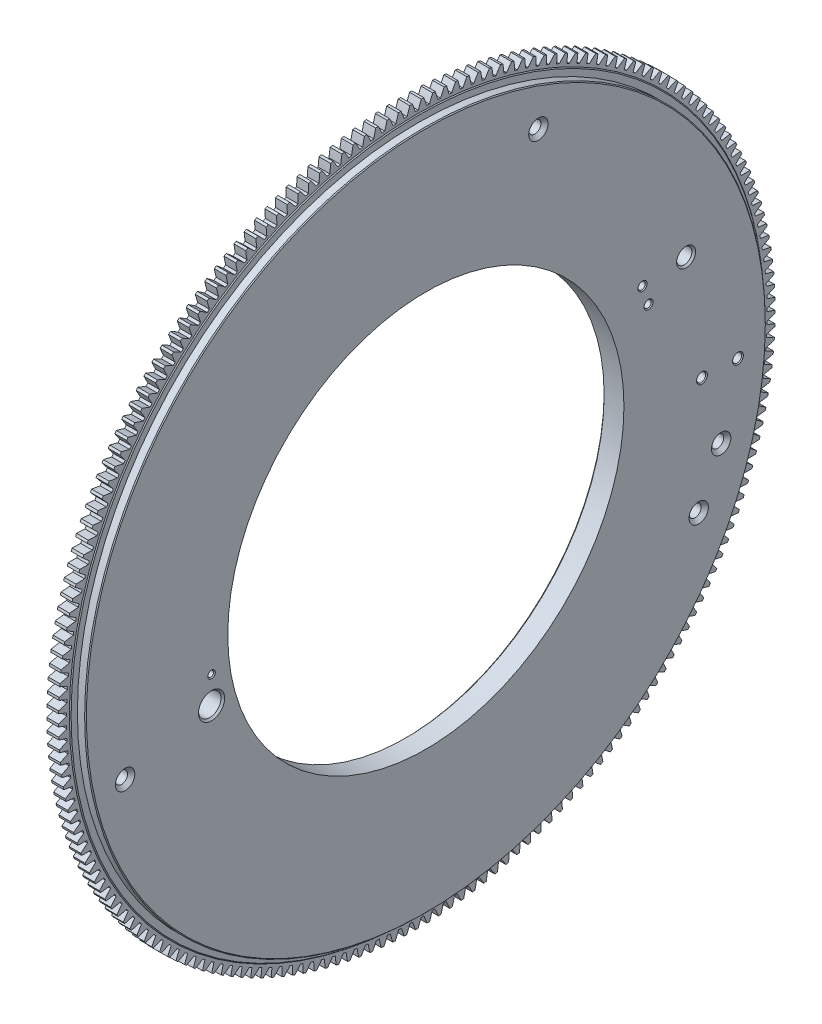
SolidWorks part; units mm, degrees
ref_plane "Plane1" through (0, 0, 0) normal (0, 0, 1) x (1, 0, 0)
ref_plane "Plane2" through (0, 0, 0) normal (0, 1, 0) x (1, 0, 0)
ref_plane "Plane3" through (0, 0, 0) normal (1, 0, 0) x (0, 0, -1)
sketch "HoldingSke" plane through (0, 0, 0) normal (0, 1, 0) x (1, 0, 0)
  line L0 (0, 0) -> (0.4698, -0.171)
  line L1 (-15, 0) -> (100, 0) construction
  line L2 (0, 0) -> (-2.1039, 2.3779)
  line L3 (0, 0) -> (-11.863, 4.5341)
  line L4 (0, 0) -> (-8.2586, -2.5249)
  line L5 (0, 0) -> (-46.8476, -17.4728)
  line L6 (0, 0) -> (-10.7765, -7.2709)
  line L7 (-2.1039, 2.3779) -> (8.6586, 51.206)
  line L8 (-76.2, 54.61) -> (-73.4, 54.61)
  line L9 (-71.009, 38.7566) -> (-53.1078, 45.2721)
  line L10 (-76.2, 71.12) -> (104.1128, 71.12)
  line L11 (0, 0) -> (-13, 0)
  line L12 (-76.2, 101.6) -> (-76.133, 101.6)
  line L13 (24.9733, 27.94) -> (52.9518, 28.4284)
  line L14 (24.9733, 27.94) -> (24.9743, 27.94)
  line L15 (24.9733, 27.94) -> (100.4006, 29.5858)
  line L16 (-63.627, -2) -> (-12.827, -2)
  circle A0 centre (0, 0) radius 9
  circle A1 centre (0, 0) radius 37.5
  circle A2 centre (0, 0) radius 37.5
  circle A3 centre (0, 0) radius 9
sketch "BasProSke" plane through (0, 0, 0) normal (0, 1, 0) x (1, 0, 0)
  line L0 (-10, 0) -> (60, 0) construction
  line L1 (0, 0) -> (0, 199)
  line L2 (0, 0) -> (13, 0)
  line L3 (13, 0) -> (13, 199)
  line L4 (13, 199) -> (0, 199)
revolve "Base-Revolve" add sketch "BasProSke" angle 360 about L0
sketch "TooCutSke" plane through (0, 0, 0) normal (1, 0, 0) x (0, 0, -1)
  line L1 (0, 0) -> (0, 107) construction
  line L2 (0, 0) -> (-1.688, 196.9928) construction
  line L3 (0, 0) -> (-6.2827, 393.9392) construction
  line L4 (-1.688, 196.9928) -> (-3.1414, 196.9696) construction
  arc A0 (0.7905, 194.4974) -> (-0.7905, 194.4974) centre (0, 0) ccw
  arc A1 (2.4841, 199.0099) -> (-2.4841, 199.0099) centre (0, 0) ccw
  circle A2 centre (0, 0) radius 197 construction
  circle A3 centre (0, 0) radius 185.1194 construction
  arc A4 (-0.7905, 194.4974) -> (-2.4841, 199.0099) centre (-75.378, 169.078) ccw
  arc A5 (2.4841, 199.0099) -> (0.7905, 194.4974) centre (75.378, 169.078) ccw
extrude "ToothCut" cut sketch "TooCutSke" along normal through all
fillet "Breaks" [suppressed] radius 0.04
fillet "RootFillets" [suppressed] radius 0.501
pattern_circular "TeethCuts" count 197 over 360 about axis through (0, 0, 0) along (1, 0, 0) of "ToothCut"
sketch "HubNeaOneSke" plane through (0, 0, 0) normal (-1, 0, 0) x (0, 0, 1)
  circle A0 centre (0, 0) radius 37.5
extrude "HubNearOne" [suppressed] add sketch "HubNeaOneSke" along normal blind 37.0002
sketch "HubNeaBotSke" plane through (0, 0, 0) normal (-1, 0, 0) x (0, 0, 1)
  circle A0 centre (0, 0) radius 37.5
extrude "HubNearBoth" [suppressed] add sketch "HubNeaBotSke" along normal blind 18.5001
ref_plane "FarPln" through (13, 0, 0) normal (1, 0, 0) x (0, 0, -1)
sketch "HubFarSke" plane through (13, 0, 0) normal (1, 0, 0) x (0, 0, -1)
  circle A0 centre (0, 0) radius 37.5
extrude "HubFar" [suppressed] add sketch "HubFarSke" along normal blind 18.5001
sketch "BorSke" plane through (0, 0, 0) normal (1, 0, 0) x (0, 0, -1)
  circle A0 centre (0, 0) radius 9
extrude "Bore" cut sketch "BorSke" along normal mid plane 100.0004
sketch "KeySke" plane through (0, 0, 0) normal (1, 0, 0) x (0, 0, -1)
  line L0 (-3, 0) -> (-3, 11.8)
  line L1 (-3, 11.8) -> (3, 11.8)
  line L2 (3, 11.8) -> (3, 0)
  line L3 (0, 0) -> (0, 34) construction
  line L4 (-3, 0) -> (3, 0)
extrude "Keyway" [suppressed] cut sketch "KeySke" along normal mid plane 100.0004
pattern_circular "Keyway2" [suppressed] count 2 every 90 about axis through (-10, 0, 0) along (1, 0, 0)
sketch "Esquisse1" plane through (13, 0, 0) normal (1, 0, 0) x (0, 0, -1)
  circle A0 centre (0, 0) radius 110
  dimension "D1" = 220
extrude "Extrusion1" cut sketch "Esquisse1" against normal through all
sketch "Esquisse2" plane through (13, 0, 0) normal (1, 0, 0) x (0, 0, -1)
  circle A1 centre (0, 0) radius 199
  arc A2 (3.873, 198.9623) -> (2.4737, 198.9846) centre (0, 0) ccw construction
extrude "Extrusion2" cut sketch "Esquisse2" against normal blind 1
chamfer "Chanfrein1" distance 1 angle 45 1 edges at (0, 0, -110)
sketch "Esquisse3" plane through (0, 0, 0) normal (-1, 0, 0) x (0, 0, 1)
  circle A0 centre (0, 0) radius 132
  circle A1 centre (0, 0) radius 178.5
  dimension "D1" = 264
  dimension "D2" = 357
extrude "Extrusion3" cut sketch "Esquisse3" against normal blind 1
sketch "Esquisse4" plane through (0, 0, 0) normal (-1, 0, 0) x (0, 0, 1)
  circle A0 centre (0, 0) radius 193
  circle A2 centre (0, 0) radius 199
  arc A3 (-2.4737, 198.9846) -> (-3.873, 198.9623) centre (0, 0) ccw construction
  dimension "D1" = 386
extrude "Extrusion4" cut sketch "Esquisse4" against normal blind 0.5
chamfer "Chanfrein2" distance 0.5 angle 45 3 edges at (0, 0, 132) (0, 0, 178.5) (0, 0, 193)
sketch "Esquisse5" plane through (12, 0, 0) normal (1, 0, 0) x (0, 0, -1)
  circle A1 centre (0, 0) radius 199
  circle A2 centre (0, 0) radius 189
  arc A3 (-120.4824, 158.3824) -> (-121.5933, 157.5312) centre (0, 0) ccw construction
  dimension "D1" = 378
extrude "Extrusion5" cut sketch "Esquisse5" against normal blind 4.5
sketch "Esquisse6" plane through (7.5, 0, 0) normal (1, 0, 0) x (0, 0, -1)
  circle A0 centre (0, 0) radius 193
  circle A1 centre (0, 0) radius 199
  arc A2 (-120.4824, 158.3824) -> (-121.5933, 157.5312) centre (0, 0) ccw construction
  dimension "D1" = 386
extrude "Extrusion6" cut sketch "Esquisse6" against normal blind 0.5
chamfer "Chanfrein3" distance 0.5 angle 45 1 edges at (7.5, 0, -193)
chamfer "Chanfrein4" distance 0.5 angle 45 1 edges at (12, 0, -189)
hole_wizard "Diamètre du perçage Ø12.5 (12.5)1" positions "Esquisse8" profile "Esquisse7" hole size "Ø12.5" standard "ISO"
sketch "Esquisse8" plane through (12, 0, 0) normal (1, 0, 0) x (0, 0, -1)
  circle A1 centre (0, 0) radius 110 construction
  point P0 (-119, -29.5)
  dimension "D1" = 29.5
  dimension "D2" = 119
sketch "Esquisse7" plane through (12, -29.5, 119) normal (0, 1, 0) x (0, 0, -1)
  line L0 (0, 0) -> (0, 12)
  line L1 (0, 12) -> (6.25, 12)
  line L2 (6.25, 12) -> (6.25, 0)
  line L5 (6.25, 0) -> (0, 0)
  line L11 (0, -6.35) -> (0, 107.95) construction
  dimension "Diamètre du perçage jusqu'au prochain" = 12.5
  dimension "Profondeur du perçage jusqu'au prochain" = 12
hole_wizard "Diamètre du perçage Ø8.5 (8.5)1" positions "Esquisse10" profile "Esquisse9" hole size "Ø8.5" standard "ISO"
sketch "Esquisse10" plane through (12, 0, 0) normal (1, 0, 0) x (0, 0, -1)
  circle A1 centre (0, 0) radius 110 construction
  point P0 (144.5, 54.5)
  dimension "D1" = 144.5
  dimension "D2" = 54.5
sketch "Esquisse9" plane through (12, 54.5, -144.5) normal (0, 1, 0) x (0, 0, -1)
  line L0 (0, 0) -> (0, 12)
  line L1 (0, 12) -> (4.25, 12)
  line L2 (4.25, 12) -> (4.25, 0)
  line L5 (4.25, 0) -> (0, 0)
  line L11 (0, -6.35) -> (0, 107.95) construction
  dimension "Diamètre du perçage jusqu'au prochain" = 8.5
  dimension "Profondeur du perçage jusqu'au prochain" = 12
hole_wizard "Diamètre du perçage Ø6.7 (6.75)1" positions "Esquisse12" profile "Esquisse13" hole size "Ø6.7" standard "ISO"
sketch "Esquisse12" plane through (12, 0, 0) normal (1, 0, 0) x (0, 0, -1)
  circle A1 centre (0, 0) radius 188.5 construction
  circle A7 centre (144.5, 54.5) radius 4.25 construction
  circle A8 centre (0, 0) radius 110 construction
  point P0 (164, -44.9156)
  point P1 (62.5, 157)
  point P3 (-167, -41)
  point P5 (151.5, -72)
  dimension "D4" = 164
  dimension "D3" = 101.31
  dimension "D1" = 62.5
  dimension "D2" = 157
  dimension "D5" = 151.5
  dimension "D6" = 72
  dimension "D7" = 167
  dimension "D8" = 41
sketch "Esquisse13" plane through (12, -44.9156, -164) normal (0, 1, 0) x (0, 0, -1)
  line L0 (0, 0) -> (0, 12)
  line L1 (0, 12) -> (3.375, 12)
  line L2 (3.375, 12) -> (3.375, 0)
  line L5 (3.375, 0) -> (0, 0)
  line L11 (0, -6.35) -> (0, 107.95) construction
  dimension "Diamètre du perçage jusqu'au prochain" = 6.75
  dimension "Profondeur du perçage jusqu'au prochain" = 12
chamfer "Chanfrein5" distance 2 angle 45 4 edges at (12, -41, 163.625) (12, 157, -65.875) (12, -72, -154.875) (12, -44.9156, -167.375)
thread "Filetage3" pitch 1.25 start angle 0, offset 5, length 25, pitch 1.25, diameter 6.75
ref_plane "Plan3" through (15, -72, -148.125) normal (0, -1, 0) x (0, 0, 1)
sketch "Profil de filetage3" plane through (15, -72, -148.125) normal (0, -1, 0) x (0, 0, 1)
  line L0 (0, 0) -> (0, 1.25) construction
  line L1 (0, 0) -> (0.6766, 0.3906)
  line L2 (0.6766, 0.3906) -> (0.6766, 0.5469)
  line L3 (0.6766, 0.5469) -> (0, 0.9375)
  line L4 (0.6766, 0.4687) -> (0, 0.4687) construction
  line L11 (0, 0) -> (0, 0.9375)
  point P2 (0, 0)
  dimension "Pitch" = 1.25
  dimension "Profile_Angle" = 60
  dimension "Profile_Land" = 0.1562
  dimension "Profile_Height" = 0.6766
thread "Filetage4" pitch 1.25 start angle 0, offset 5, length 25, pitch 1.25, diameter 6.75
ref_plane "Plan4" through (15, -44.9156, -160.625) normal (0, -1, 0) x (0, 0, 1)
sketch "Profil de filetage4" plane through (15, -44.9156, -160.625) normal (0, -1, 0) x (0, 0, 1)
  line L0 (0, 0) -> (0, 1.25) construction
  line L1 (0, 0) -> (0.6766, 0.3906)
  line L2 (0.6766, 0.3906) -> (0.6766, 0.5469)
  line L3 (0.6766, 0.5469) -> (0, 0.9375)
  line L4 (0.6766, 0.4687) -> (0, 0.4687) construction
  line L11 (0, 0) -> (0, 0.9375)
  point P2 (0, 0)
  dimension "Pitch" = 1.25
  dimension "Profile_Angle" = 60
  dimension "Profile_Land" = 0.1562
  dimension "Profile_Height" = 0.6766
thread "Filetage5" pitch 1.25 start angle 0, offset 5, length 25, pitch 1.25, diameter 6.75
ref_plane "Plan5" through (15, 157, -59.125) normal (0, -1, 0) x (0, 0, 1)
sketch "Profil de filetage5" plane through (15, 157, -59.125) normal (0, -1, 0) x (0, 0, 1)
  line L0 (0, 0) -> (0, 1.25) construction
  line L1 (0, 0) -> (0.6766, 0.3906)
  line L2 (0.6766, 0.3906) -> (0.6766, 0.5469)
  line L3 (0.6766, 0.5469) -> (0, 0.9375)
  line L4 (0.6766, 0.4687) -> (0, 0.4687) construction
  line L11 (0, 0) -> (0, 0.9375)
  point P2 (0, 0)
  dimension "Pitch" = 1.25
  dimension "Profile_Angle" = 60
  dimension "Profile_Land" = 0.1562
  dimension "Profile_Height" = 0.6766
thread "Filetage6" pitch 1.25 start angle 0, offset 5, length 25, pitch 1.25, diameter 6.75
ref_plane "Plan6" through (15, -41, 170.375) normal (0, -1, 0) x (0, 0, 1)
sketch "Profil de filetage6" plane through (15, -41, 170.375) normal (0, -1, 0) x (0, 0, 1)
  line L0 (0, 0) -> (0, 1.25) construction
  line L1 (0, 0) -> (0.6766, 0.3906)
  line L2 (0.6766, 0.3906) -> (0.6766, 0.5469)
  line L3 (0.6766, 0.5469) -> (0, 0.9375)
  line L4 (0.6766, 0.4687) -> (0, 0.4687) construction
  line L11 (0, 0) -> (0, 0.9375)
  point P2 (0, 0)
  dimension "Pitch" = 1.25
  dimension "Profile_Angle" = 60
  dimension "Profile_Land" = 0.1562
  dimension "Profile_Height" = 0.6766
hole_wizard "Diamètre du perçage Ø5.0 (5)1" positions "Esquisse15" profile "Esquisse14" hole size "Ø5.0" standard "ISO"
sketch "Esquisse15" plane through (12, 0, 0) normal (1, 0, 0) x (0, 0, -1)
  circle A1 centre (0, 0) radius 110 construction
  point P1 (173.34, -8.6824)
  point P3 (153.35, -8.05)
  dimension "D1" = 153.35
  dimension "D2" = 8.05
  dimension "D3" = 173.34
  dimension "D4" = 20
sketch "Esquisse14" plane through (12, -8.6824, -173.34) normal (0, 1, 0) x (0, 0, -1)
  line L0 (0, 0) -> (0, 12)
  line L1 (0, 12) -> (2.5, 12)
  line L2 (2.5, 12) -> (2.5, 0)
  line L5 (2.5, 0) -> (0, 0)
  line L11 (0, -6.35) -> (0, 107.95) construction
  dimension "Diamètre du perçage jusqu'au prochain" = 5
  dimension "Profondeur du perçage jusqu'au prochain" = 12
hole_wizard "Dégagement M141" positions "Esquisse17" profile "Esquisse16" hole size "M14" standard "Ansi Métrique"
sketch "Esquisse17" plane through (12, 0, 0) normal (1, 0, 0) x (0, 0, -1)
  arc A1 (-120.4824, 158.3824) -> (-121.5933, 157.5312) centre (0, 0) ccw construction
  circle A2 centre (0, 0) radius 110 construction
  point P0 (120.32, 52.55)
  point P1 (123.66, 42.1)
  dimension "D1" = 123.66
  dimension "D2" = 120.32
  dimension "D3" = 42.1
  dimension "D4" = 52.55
sketch "Esquisse16" plane through (12, 52.55, -120.32) normal (0, 1, 0) x (0, 0, -1)
  line L0 (0, 0) -> (0, 9.2017)
  line L1 (0, 9.2017) -> (2, 8)
  line L2 (2, 8) -> (2, 0)
  line L5 (2, 0) -> (0, 0)
  line L10 (0, 9.2017) -> (-2, 8) construction
  line L11 (0, -6.35) -> (0, 107.95) construction
  dimension "Diamètre du perçage" = 4
  dimension "Profondeur du perçage" = 8
  dimension "Angle de pointe" = 118
chamfer "Chanfrein6" distance 1 angle 45 2 edges at (12, 54.5, -148.75) (12, -29.5, 112.75)
chamfer "Chanfrein7" distance 0.5 angle 45 4 edges at (12, -8.6824, -175.84) (12, -8.05, -155.85) (12, 52.55, -122.32) (12, 42.1, -125.66)
thread "Filetage7" pitch 1 start angle 0, offset 5, length 25, pitch 1, diameter 5
ref_plane "Plan7" through (16.5, -8.05, -150.85) normal (0, -1, 0) x (0, 0, 1)
sketch "Profil de filetage7" plane through (16.5, -8.05, -150.85) normal (0, -1, 0) x (0, 0, 1)
  line L0 (0, 0) -> (0, 1) construction
  line L1 (0, 0) -> (0.5413, 0.3125)
  line L2 (0.5413, 0.3125) -> (0.5413, 0.4375)
  line L3 (0.5413, 0.4375) -> (0, 0.75)
  line L4 (0.5413, 0.375) -> (0, 0.375) construction
  line L11 (0, 0) -> (0, 0.75)
  point P2 (0, 0)
  dimension "Pitch" = 1
  dimension "Profile_Angle" = 60
  dimension "Profile_Land" = 0.125
  dimension "Profile_Height" = 0.5413
thread "Filetage8" pitch 1 start angle 0, offset 5, length 25, pitch 1, diameter 5
ref_plane "Plan8" through (16.5, -8.6824, -170.84) normal (0, -1, 0) x (0, 0, 1)
sketch "Profil de filetage8" plane through (16.5, -8.6824, -170.84) normal (0, -1, 0) x (0, 0, 1)
  line L0 (0, 0) -> (0, 1) construction
  line L1 (0, 0) -> (0.5413, 0.3125)
  line L2 (0.5413, 0.3125) -> (0.5413, 0.4375)
  line L3 (0.5413, 0.4375) -> (0, 0.75)
  line L4 (0.5413, 0.375) -> (0, 0.375) construction
  line L11 (0, 0) -> (0, 0.75)
  point P2 (0, 0)
  dimension "Pitch" = 1
  dimension "Profile_Angle" = 60
  dimension "Profile_Land" = 0.125
  dimension "Profile_Height" = 0.5413
hole_wizard "Diamètre du perçage Ø3.2 (3.2)1" positions "Esquisse19" profile "Esquisse18" hole size "Ø3.2" standard "ISO"
sketch "Esquisse19" plane through (12, 0, 0) normal (1, 0, 0) x (0, 0, -1)
  line L0 (-119, -14.5) -> (-119, -29.5) construction
  circle A0 centre (-119, -29.5) radius 6.25 construction
  point P1 (-119, -14.5)
  dimension "D1" = 15
sketch "Esquisse18" plane through (12, -14.5, 119) normal (0, 1, 0) x (0, 0, -1)
  line L0 (0, 0) -> (0, 8.9614)
  line L1 (0, 8.9614) -> (1.6, 8)
  line L2 (1.6, 8) -> (1.6, 0)
  line L5 (1.6, 0) -> (0, 0)
  line L10 (0, 8.9614) -> (-1.6, 8) construction
  line L11 (0, -6.35) -> (0, 107.95) construction
  dimension "Diamètre du perçage" = 3.2
  dimension "Profondeur du perçage" = 8
  dimension "Angle de pointe" = 118
chamfer "Chanfrein8" distance 0.5 angle 45 1 edges at (12, -14.5, 117.4)
thread "Filetage1" pitch 1.5 start angle 0, offset 5, length 25, pitch 1.5, diameter 12.5
ref_plane "Plan1" through (16, -29.5, 125.25) normal (0, -1, 0) x (0, 0, 1)
sketch "Profil de filetage1" plane through (16, -29.5, 125.25) normal (0, -1, 0) x (0, 0, 1)
  line L0 (0, 0) -> (0, 1.5) construction
  line L1 (0, 0) -> (0.8119, 0.4687)
  line L2 (0.8119, 0.4687) -> (0.8119, 0.6562)
  line L3 (0.8119, 0.6562) -> (0, 1.125)
  line L4 (0.8119, 0.5625) -> (0, 0.5625) construction
  line L11 (0, 0) -> (0, 1.125)
  point P2 (0, 0)
  dimension "Pitch" = 1.5
  dimension "Profile_Angle" = 60
  dimension "Profile_Land" = 0.1875
  dimension "Profile_Height" = 0.8119
thread "Filetage2" pitch 1.5 start angle 0, offset 5, length 25, pitch 1.5, diameter 8.5
ref_plane "Plan2" through (16, 54.5, -140.25) normal (0, -1, 0) x (0, 0, 1)
sketch "Profil de filetage2" plane through (16, 54.5, -140.25) normal (0, -1, 0) x (0, 0, 1)
  line L0 (0, 0) -> (0, 1.5) construction
  line L1 (0, 0) -> (0.8119, 0.4687)
  line L2 (0.8119, 0.4687) -> (0.8119, 0.6562)
  line L3 (0.8119, 0.6562) -> (0, 1.125)
  line L4 (0.8119, 0.5625) -> (0, 0.5625) construction
  line L11 (0, 0) -> (0, 1.125)
  point P2 (0, 0)
  dimension "Pitch" = 1.5
  dimension "Profile_Angle" = 60
  dimension "Profile_Land" = 0.1875
  dimension "Profile_Height" = 0.8119
equation "\"Pitch@HoldingSke\" = 1 / \"Module@HoldingSke\""
equation "\"Overcut_dia@TooCutSke\" = (\"Num_teeth@HoldingSke\" + 2 * \"Addendum_fac@HoldingSke\") / \"Pitch@HoldingSke\" + 0.002 * 25.4"
equation "\"Pitch_dia@TooCutSke\" = \"Num_teeth@HoldingSke\" / \"Pitch@HoldingSke\""
equation "\"Base_dia@TooCutSke\" = \"Num_teeth@HoldingSke\" / \"Pitch@HoldingSke\" * cos((\"Ap@HoldingSke\"  * 3.14159265 / 180))"
equation "\"Root_dia@TooCutSke\" = (\"Num_teeth@HoldingSke\" + 2) / \"Pitch@HoldingSke\" - 2 * (\"Addendum_fac@HoldingSke\" + \"Dedendum_fac@HoldingSke\") / \"Pitch@HoldingSke\" - \"Dedendum_add@HoldingSke\" * 2"
equation "\"Half_ang@TooCutSke\" = 180 / \"Num_teeth@HoldingSke\""
equation "\"Half_CT@TooCutSke\" = \"Num_teeth@HoldingSke\" / \"Pitch@HoldingSke\" * sin((3.14159265 / 2 / \"Num_teeth@HoldingSke\")) / 2 - 7 * \"Backlash@HoldingSke\" / 4"
equation "\"Flank_rad@TooCutSke\" = \"Num_teeth@HoldingSke\" / \"Pitch@HoldingSke\" / 5"
equation "\"Radius@RootFillets\" = \"Clearance_fac@HoldingSke\" / \"Pitch@HoldingSke\" + \"Dedendum_add@HoldingSke\""
equation "\"Break_rad@Breaks\" = 0.02 / \"Pitch@HoldingSke\""
equation "\"Thickness@HoldingSke\" = \"Width@HoldingSke\""
equation "\"OAL@HoldingSke\" = \"Thickness@HoldingSke\""
equation "\"MHD@HoldingSke\" = (\"Num_teeth@HoldingSke\" + 2) / \"Pitch@HoldingSke\" - 2 * (\"Addendum_fac@HoldingSke\" + \"Dedendum_fac@HoldingSke\")  / \"Pitch@HoldingSke\" - \"Dedendum_add@HoldingSke\" * 2"
equation "\"MBD@HoldingSke\" = (\"Num_teeth@HoldingSke\" + 2) / \"Pitch@HoldingSke\" - 2 * (\"Addendum_fac@HoldingSke\" + \"Dedendum_fac@HoldingSke\")  / \"Pitch@HoldingSke\" - \"Dedendum_add@HoldingSke\" * 2 - 0.002 * 25.4"
equation "\"MHD@HoldingSke\" = ((sgn( \"MHD@HoldingSke\" - \"Hub_dia@HoldingSke\" )-1)*( \"MHD@HoldingSke\" - \"Hub_dia@HoldingSke\" ))/-2+ \"Hub_dia@HoldingSke\""
equation "\"MBD@HoldingSke\" = ((sgn( \"MBD@HoldingSke\" - \"Bore@HoldingSke\" )-1)*( \"MBD@HoldingSke\" - \"Bore@HoldingSke\" ))/-2+ \"Bore@HoldingSke\""
equation "\"OAL@HoldingSke\" = ((sgn( \"OAL@HoldingSke\" - \"Overall_len@HoldingSke\" )+1)*( \"OAL@HoldingSke\" - \"Overall_len@HoldingSke\" ))/2 + \"Overall_len@HoldingSke\" + 0.000002 * 25.4"
equation "\"Num_teeth@TeethCuts\" = int( \"Show_teeth@HoldingSke\" ) + 1"
equation "\"Num_teeth@TeethCuts\" = ((sgn( \"Num_teeth@TeethCuts\" - \"Num_teeth@HoldingSke\" )-1)*( \"Num_teeth@TeethCuts\" - \"Num_teeth@HoldingSke\" ))/-2+ \"Num_teeth@HoldingSke\""
equation "\"Diameter@BasProSke\" = (\"Num_teeth@HoldingSke\" + 2 * \"Addendum_fac@HoldingSke\") / \"Pitch@HoldingSke\""
equation "\"Thickness@BasProSke\"  = \"Thickness@HoldingSke\""
equation "' \"Fillet_rad@BasProSke\" =  \"Thickness@HoldingSke\" * 0.05"
equation "' \"Fillet_rad@BasProSke\" = \"Thickness@HoldingSke\" * 0.05"
equation "\"MHD@HoldingSke\" = ((sgn( \"MHD@HoldingSke\" - \"Root_dia@TooCutSke\" )-1)*( \"MHD@HoldingSke\" - \"Root_dia@TooCutSke\" ))/-2+ \"Root_dia@TooCutSke\""
equation "\"Diameter@HubNeaOneSke\" = \"MHD@HoldingSke\""
equation "\"Length@HubNearOne\" = \"OAL@HoldingSke\" - \"Thickness@BasProSke\""
equation "\"Diameter@HubNeaBotSke\" = \"MHD@HoldingSke\""
equation "\"Length@HubNearBoth\" = ( \"OAL@HoldingSke\" - \"Thickness@BasProSke\" ) / 2.0"
equation "\"Thickness@FarPln\" = \"Thickness@BasProSke\""
equation "\"Diameter@HubFarSke\" = \"MHD@HoldingSke\""
equation "\"Length@HubFar\" = ( \"OAL@HoldingSke\" - \"Thickness@BasProSke\" ) / 2.0"
equation "\"Diameter@BorSke\" = \"MBD@HoldingSke\""
equation "\"D1@Bore\" = \"OAL@HoldingSke\" * 2.0"
equation "\"D1@Keyway\" = \"OAL@HoldingSke\" * 2.0"
equation "\"Offset@KeySke\" = \"T_dim@HoldingSke\" + \"MBD@HoldingSke\" / 2.0"
